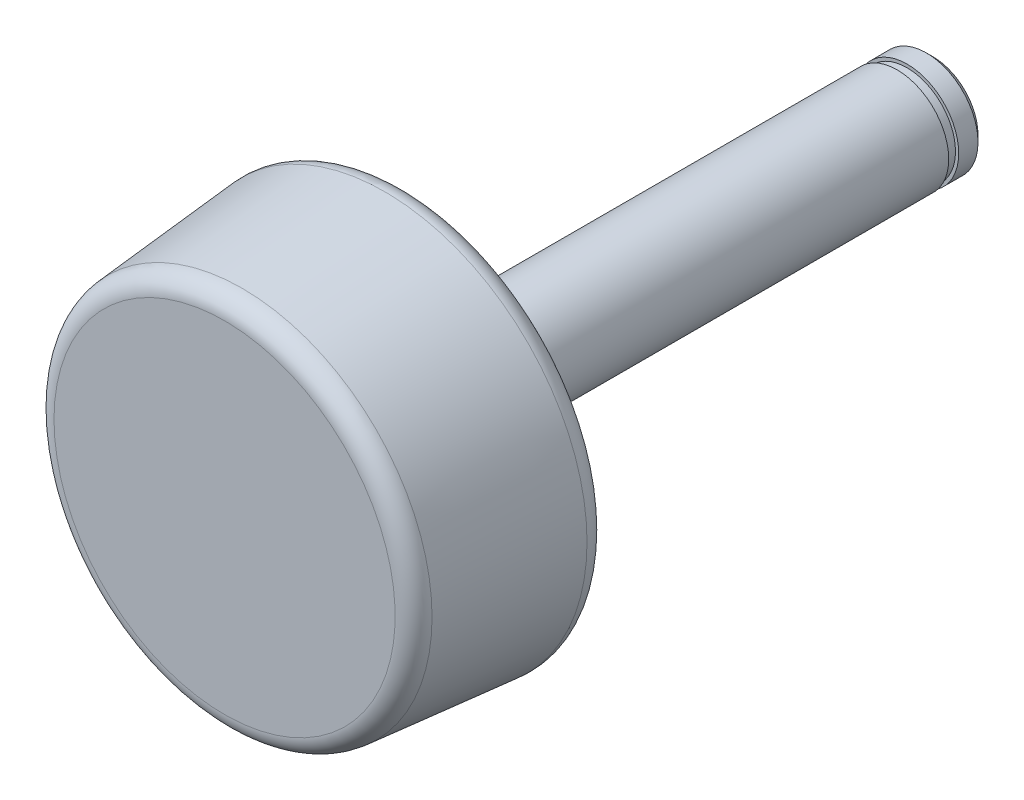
SolidWorks part; units mm, degrees
ref_plane "Plan de face" through (0, 0, 0) normal (0, 0, 1) x (1, 0, 0)
ref_plane "Plan de dessus" through (0, 0, 0) normal (0, 1, 0) x (1, 0, 0)
ref_plane "Plan de droite" through (0, 0, 0) normal (1, 0, 0) x (0, 0, -1)
sketch "Esquisse1" plane through (0, 0, 0) normal (1, 0, 0) x (0, 0, -1)
  line L0 (0, 0) -> (110, 0)
  line L1 (110, 8) -> (28.13, 8)
  line L2 (28.13, 8) -> (28.13, 31.7)
  line L3 (28.13, 31.7) -> (0, 29.24)
  line L4 (0, 29.24) -> (0, 0)
  line L5 (110, 8) -> (110, 0)
  line L6 (-27.6261, 0) -> (110, 0) construction
  line L7 (110, 0) -> (110.1945, 0.0973) construction
  dimension "D1" = 58.48
  dimension "D2" = 63.4
  dimension "D3" = 16
  dimension "D4" = 28.13
  dimension "D5" = 110
revolve "Révolution1" add sketch "Esquisse1" angle 360 about L6
fillet "Congé1" radius 3 2 edges at (31.7, 0, -28.13) (29.24, 0, 0)
sketch "Esquisse2" plane through (0, 0, 0) normal (0, 1, 0) x (1, 0, 0)
  line L1 (-8, 110) -> (-8, 28.13) construction
  line L2 (-8, 106) -> (-7.5, 106)
  line L3 (-8, 106) -> (-8, 104.45)
  line L4 (-8, 104.45) -> (-7.5, 104.45)
  line L5 (-7.5, 106) -> (-7.5, 104.45)
  line L6 (0, 110) -> (0, 88.1327) construction
  line L7 (8, 110) -> (-8, 110) construction
  dimension "D1" = 15
  dimension "D2" = 4
  dimension "D3" = 1.55
revolve "Enlèvement de matière-Révolution1" cut sketch "Esquisse2" angle 360 about L6
chamfer "Chanfrein1" distance 1 angle 45 1 edges at (8, 0, -110)
